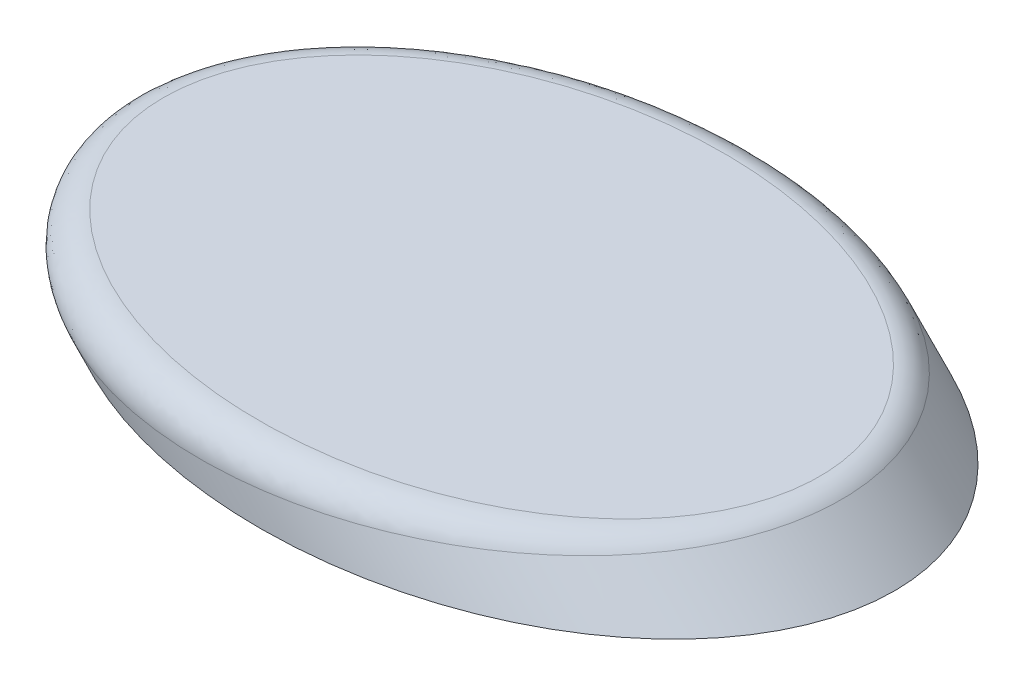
SolidWorks part; units mm, degrees
ref_plane "Front Plane" through (0, 0, 0) normal (0, 0, 1) x (1, 0, 0)
ref_plane "Top Plane" through (0, 0, 0) normal (0, 1, 0) x (1, 0, 0)
ref_plane "Right Plane" through (0, 0, 0) normal (1, 0, 0) x (0, 0, -1)
sketch "Sketch1" plane through (0, 0, 0) normal (0, 1, 0) x (1, 0, 0)
  line L1 (-76.2, -38.1) -> (76.2, -38.1)
  line L2 (-76.2, -38.1) -> (-76.2, 38.1)
  line L3 (-76.2, 38.1) -> (76.2, 38.1)
  line L4 (76.2, -38.1) -> (76.2, 38.1)
  dimension "D1" = 76.2
  dimension "D2" = 76.2
  dimension "D3" = 76.2
  dimension "D4" = 38.1
extrude "Boss-Extrude1" add sketch "Sketch1" against normal blind 6.35
sketch "Sketch2" plane through (0, 0, 38.1) normal (0, 0, 1) x (1, 0, 0)
  line L0 (-76.2, -6.35) -> (-69.85, 0)
  line L1 (-76.2, 0) -> (76.2, 0) construction
  line L2 (-76.2, -6.35) -> (-76.2, 0) construction
  dimension "D1" = 45
extrude "Cut-Extrude1" cut sketch "Sketch2" against normal through all and the other way through all
sketch "Sketch3" plane through (-34.925, 34.925, 0) normal (-0.7071, 0.7071, 0) x (0, 0, 1)
  circle A0 centre (0, 0) radius 26.9875
  dimension "D1" = 53.975
extrude "Cut-Extrude2" cut sketch "Sketch3" against normal through all flip side to cut
fillet "Fillet1" radius 3.175 1 edges at (-38.1661, 0, 0)
